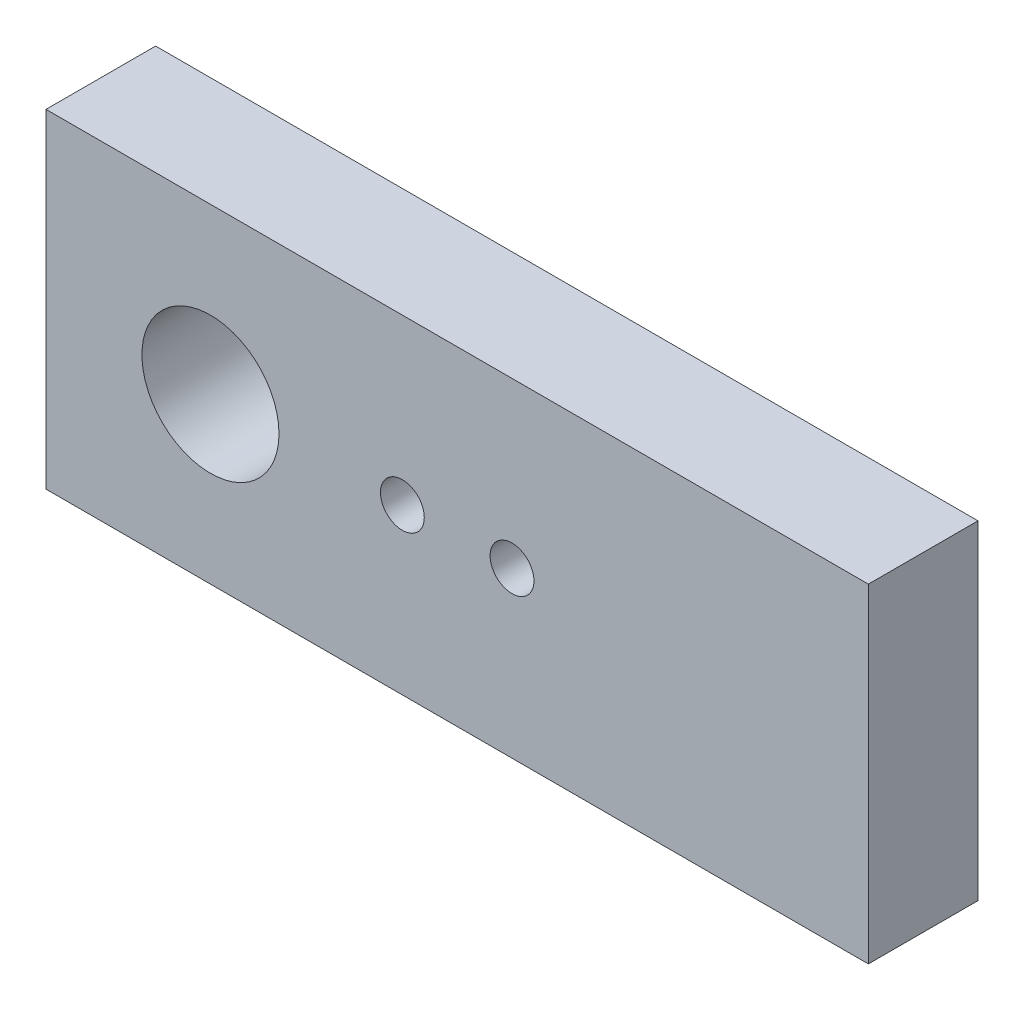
SolidWorks part; units mm, degrees
ref_plane "前视基准面" through (0, 0, 0) normal (0, 0, 1) x (1, 0, 0)
ref_plane "上视基准面" through (0, 0, 0) normal (0, 1, 0) x (1, 0, 0)
ref_plane "右视基准面" through (0, 0, 0) normal (1, 0, 0) x (0, 0, -1)
other "Configuration Table"
sketch "草图1" plane through (0, 0, 0) normal (0, 0, 1) x (1, 0, 0)
  line L1 (0, 0) -> (150, 0)
  line L2 (0, 0) -> (0, 60)
  line L3 (0, 60) -> (150, 60)
  line L4 (150, 0) -> (150, 60)
  dimension "D1" = 150
  dimension "D2" = 60
extrude "凸台-拉伸1" add sketch "草图1" against normal blind 20
sketch "草图2" plane through (0, 0, 0) normal (0, 0, 1) x (1, 0, 0)
  circle A0 centre (30, 30) radius 12.5
  dimension "D1" = 25
extrude "切除-拉伸1" cut sketch "草图2" against normal blind 20
sketch "草图3" plane through (0, 0, 0) normal (0, 0, 1) x (1, 0, 0)
  circle A0 centre (65, 30) radius 4
  circle A1 centre (85, 30) radius 4
  dimension "D1" = 20
extrude "切除-拉伸2" cut sketch "草图3" against normal blind 20
